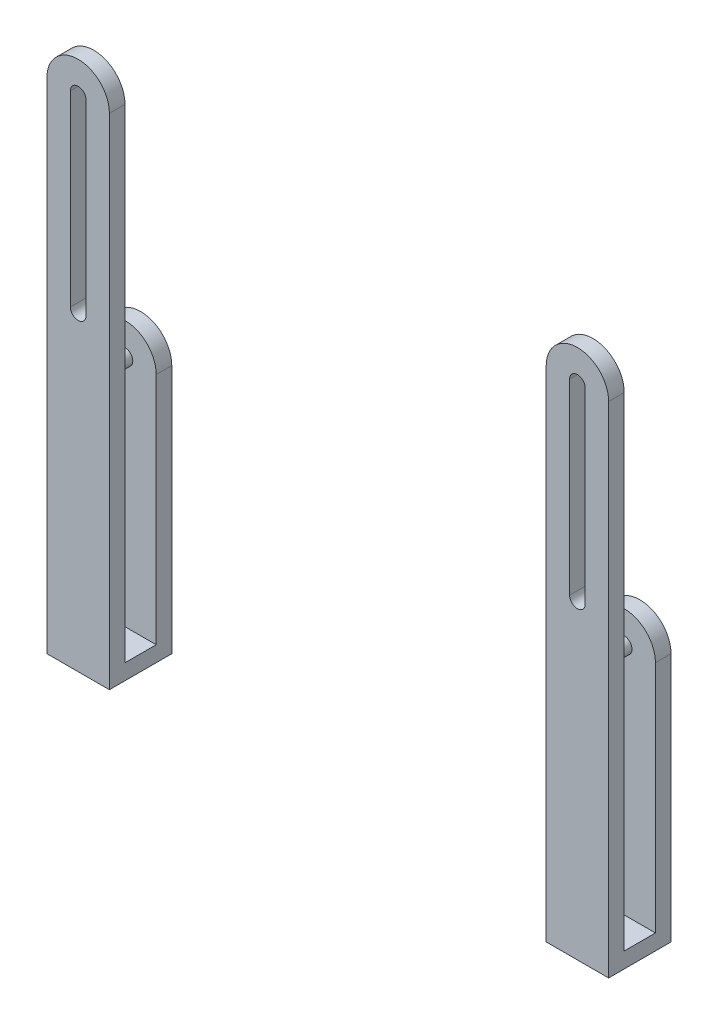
SolidWorks part; units mm, degrees
ref_plane "Front Plane" through (0, 0, 0) normal (0, 0, 1) x (1, 0, 0)
ref_plane "Top Plane" through (0, 0, 0) normal (0, 1, 0) x (1, 0, 0)
ref_plane "Right Plane" through (0, 0, 0) normal (1, 0, 0) x (0, 0, -1)
sketch "Sketch1" plane through (0, 0, 0) normal (0, 0, 1) x (1, 0, 0)
  line L0 (-25.4, 0) -> (25.4, 0)
  line L1 (25.4, 0) -> (25.4, 203.2)
  line L2 (-25.4, 203.2) -> (-25.4, 0)
  arc A0 (25.4, 203.2) -> (-25.4, 203.2) centre (0, 203.2) ccw
  dimension "D1" = 25.4
  dimension "D2" = 203.2
extrude "Extrude1" add sketch "Sketch1" along normal blind 12.7
sketch "Sketch2" plane through (0, 0, 12.7) normal (0, 0, 1) x (1, 0, 0)
  line L0 (-25.4, 203.2) -> (-25.4, 0) construction
  line L1 (-25.4, 0) -> (25.4, 0)
  line L2 (-25.4, 0) -> (-25.4, 12.7)
  line L3 (-25.4, 12.7) -> (25.4, 12.7)
  line L4 (25.4, 0) -> (25.4, 12.7)
  line L5 (25.4, 0) -> (25.4, 203.2) construction
  dimension "D1" = 12.7
extrude "Extrude2" add sketch "Sketch2" along normal blind 25.4
sketch "Sketch3" plane through (0, 0, 38.1) normal (0, 0, 1) x (1, 0, 0)
  line L0 (-25.4, 0) -> (-25.4, 406.4)
  line L1 (-25.4, 12.7) -> (-25.4, 0) construction
  line L2 (25.4, 406.4) -> (25.4, 0)
  line L3 (25.4, 0) -> (-25.4, 0)
  arc A0 (-25.4, 406.4) -> (25.4, 406.4) centre (0, 406.4) cw
  arc A1 (25.4, 203.2) -> (-25.4, 203.2) centre (0, 203.2) ccw construction
  dimension "D1" = 203.2
extrude "Extrude3" add sketch "Sketch3" along normal blind 12.7
sketch "Sketch4" plane through (0, 0, 0) normal (0, 0, -1) x (-1, 0, 0)
  circle A0 centre (0, 203.2) radius 6.35
  dimension "D1" = 12.7
sketch "Sketch5" plane through (0, 0, 50.8) normal (0, 0, 1) x (1, 0, 0)
  line L0 (0, 406.4) -> (0, 254) construction
  line L1 (-6.35, 406.4) -> (-6.35, 254)
  line L2 (6.35, 406.4) -> (6.35, 254)
  arc A0 (-6.35, 406.4) -> (6.35, 406.4) centre (0, 406.4) cw
  arc A1 (-6.35, 254) -> (6.35, 254) centre (0, 254) ccw
  dimension "D1" = 152.4
  dimension "D2" = 6.35
  dimension "D3" = 6.35
extrude "Cut-Extrude2" cut sketch "Sketch5" against normal up to next
extrude "Extrude4" add sketch "Sketch4" against normal blind 19.05 from surface at -12.7
pattern_linear "LPattern1" count 2 spacing 406.4 along (-1, 0, 0)
